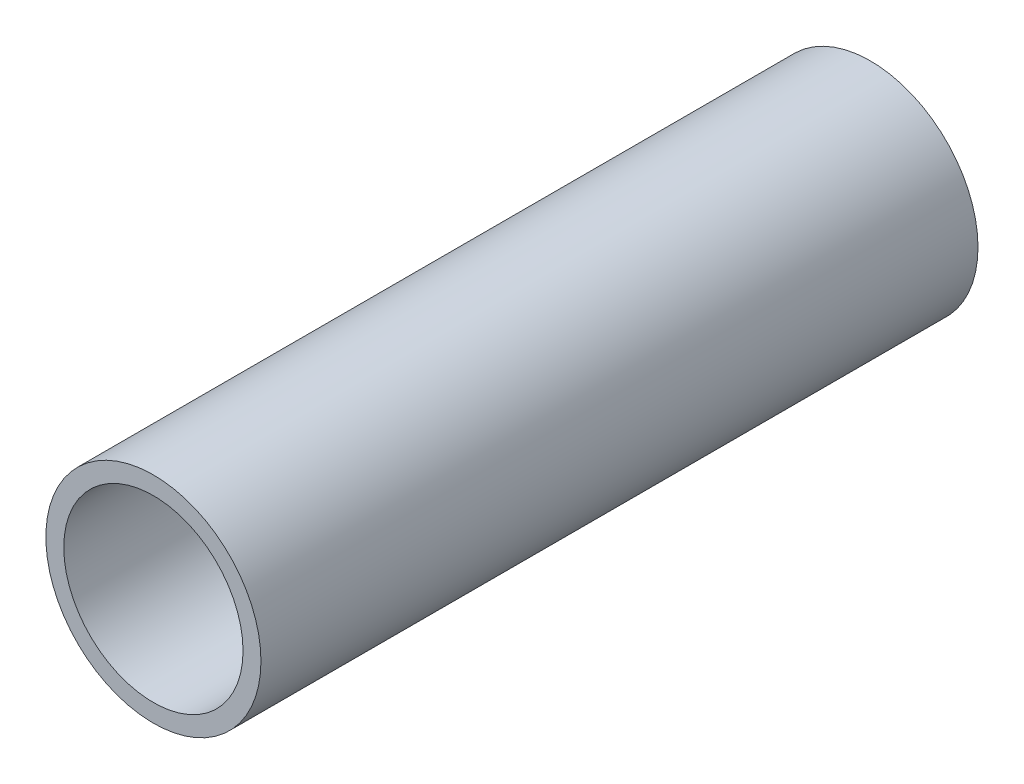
SolidWorks part; units mm, degrees
ref_plane "Plan de face" through (0, 0, 0) normal (0, 0, 1) x (1, 0, 0)
ref_plane "Plan de dessus" through (0, 0, 0) normal (0, 1, 0) x (1, 0, 0)
ref_plane "Plan de droite" through (0, 0, 0) normal (1, 0, 0) x (0, 0, -1)
sketch "Esquisse1" plane through (0, 0, 0) normal (0, 0, 1) x (1, 0, 0)
  circle A0 centre (0, 0) radius 6
  circle A1 centre (0, 0) radius 5
  dimension "D1" = 12
  dimension "D2" = 1
extrude "Extrusion1" add sketch "Esquisse1" along normal mid plane 40
